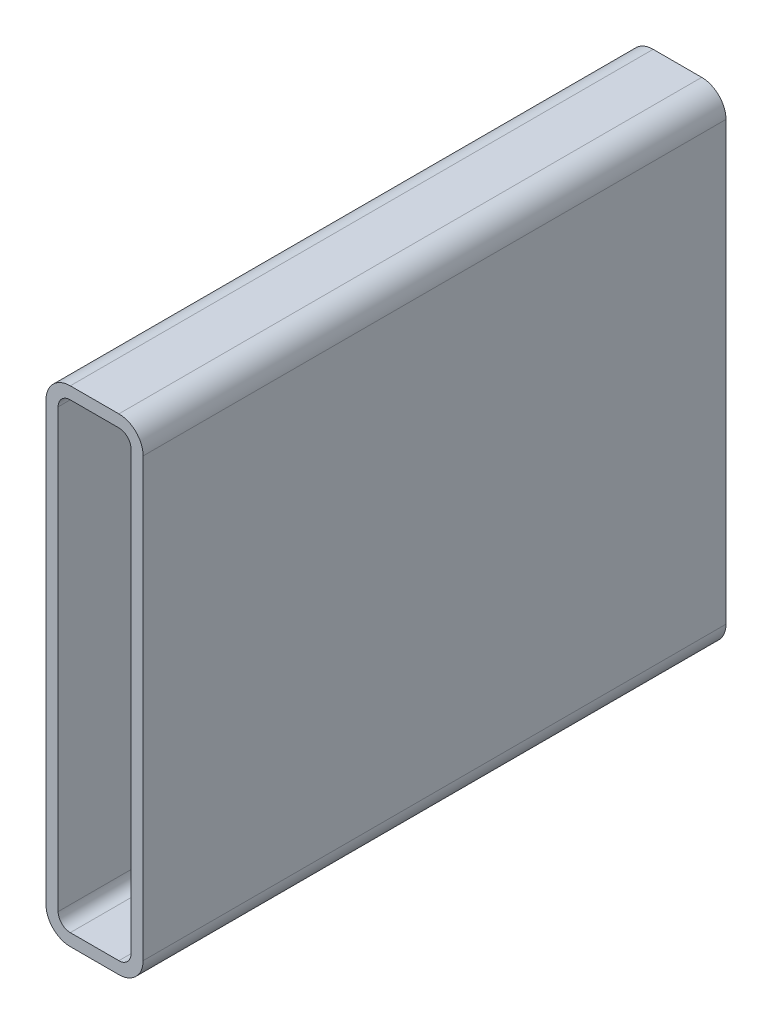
SolidWorks part; units mm, degrees
ref_plane "Front Plane" through (0, 0, 0) normal (0, 0, 1) x (1, 0, 0)
ref_plane "Top Plane" through (0, 0, 0) normal (0, 1, 0) x (1, 0, 0)
ref_plane "Right Plane" through (0, 0, 0) normal (1, 0, 0) x (0, 0, -1)
sketch "Sketch1" plane through (0, 0, 0) normal (0, 0, 1) x (1, 0, 0)
  line B0 (12.7, 254) -> (38.1, 254)
  arc B1 (50.8, 241.3) -> (38.1, 254) centre (38.1, 241.3) ccw
  line B2 (50.8, 241.3) -> (50.8, 12.7)
  arc B3 (38.1, 0) -> (50.8, 12.7) centre (38.1, 12.7) ccw
  line B4 (38.1, 0) -> (12.7, 0)
  arc B5 (0, 12.7) -> (12.7, 0) centre (12.7, 12.7) ccw
  line B6 (0, 12.7) -> (0, 241.3)
  arc B7 (12.7, 254) -> (0, 241.3) centre (12.7, 241.3) ccw
  line B8 (12.7, 247.65) -> (38.1, 247.65)
  arc B9 (44.45, 241.3) -> (38.1, 247.65) centre (38.1, 241.3) ccw
  line B10 (44.45, 241.3) -> (44.45, 12.7)
  arc B11 (38.1, 6.35) -> (44.45, 12.7) centre (38.1, 12.7) ccw
  line B12 (38.1, 6.35) -> (12.7, 6.35)
  arc B13 (6.35, 12.7) -> (12.7, 6.35) centre (12.7, 12.7) ccw
  line B14 (6.35, 12.7) -> (6.35, 241.3)
  arc B15 (12.7, 247.65) -> (6.35, 241.3) centre (12.7, 241.3) ccw
sketch_block_instance "HSS10x2x0.250-1"
sketch_block "HSS10x2x0.250"
extrude "Boss-Extrude1" add sketch "Sketch1" along normal blind 304.8
